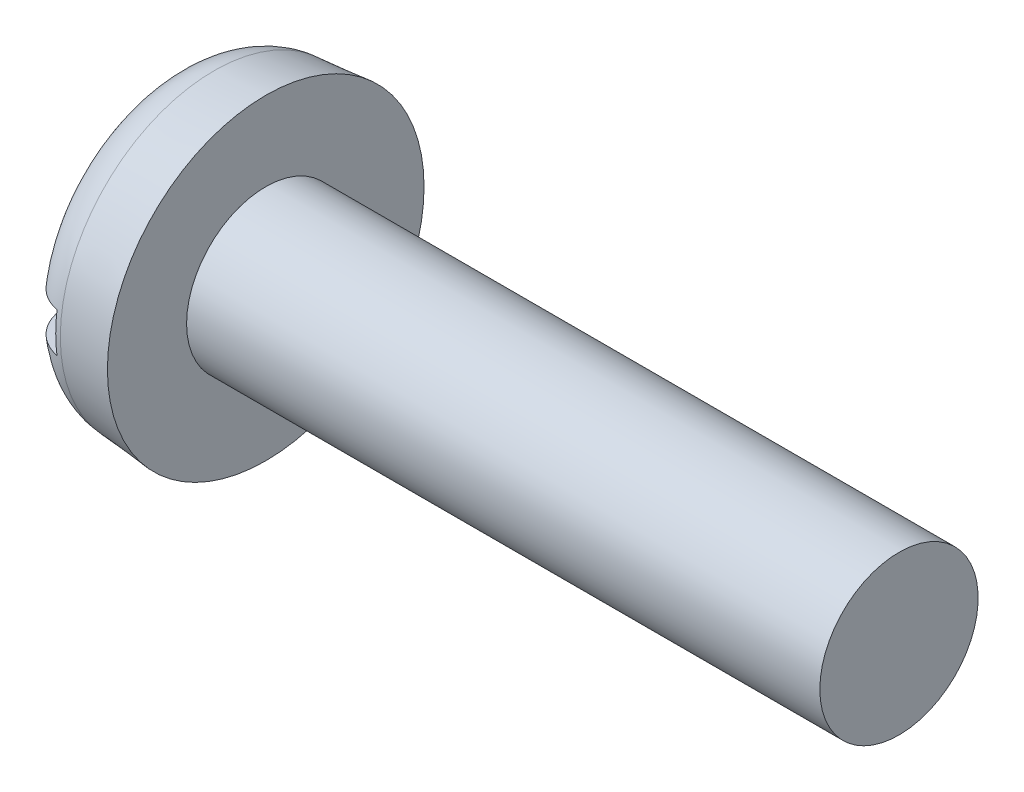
SolidWorks part; units mm, degrees
ref_plane "Plane1" through (0, 0, 0) normal (0, 0, 1) x (1, 0, 0)
ref_plane "Plane2" through (0, 0, 0) normal (0, 1, 0) x (1, 0, 0)
ref_plane "Plane3" through (0, 0, 0) normal (1, 0, 0) x (0, 0, -1)
other "Configuration Table"
sketch "BodySke" plane through (0, 0, 0) normal (0, 0, 1) x (1, 0, 0)
  line L0 (6, 5) -> (6, 10)
  line L1 (0, 0) -> (0, 9.4751)
  line L2 (-25.4, 0) -> (127, 0) construction
  line L3 (46, 0) -> (0, 0)
  line L4 (6, 5) -> (46, 5)
  line L5 (46, 5) -> (46, 0)
  line L6 (0, 9.4751) -> (6, 10)
  line L9 (7.5, 6.5875) -> (7.5, -2.9375) construction
  line L10 (6, 6.35) -> (6, -3.175) construction
revolve "Base-Revolve" add sketch "BodySke"
fillet "Fillet1" [suppressed] radius 0.4
fillet "Fillet2" radius 3 1 edges at (0, 0, 9.4751)
sketch "Sketch2" plane through (0, 0, 0) normal (1, 0, 0) x (0, 0, -1)
  line L0 (10, -1.25) -> (-10, -1.25)
  line L1 (10, -1.25) -> (10, 1.25)
  line L2 (-10, 1.25) -> (10, 1.25)
  line L3 (-10, 1.25) -> (-10, -1.25)
extrude "Slot" cut sketch "Sketch2" along normal blind 2.4
sketch "ThdSchSke" plane through (0, 0, 0) normal (0, 0, 1) x (1, 0, 0)
  line L0 (9, -4.1885) -> (8.4318, -5)
  line L1 (9, -4.1885) -> (9.5682, -5)
  line L2 (9.5682, -5) -> (9.5682, -6.25)
  line L3 (-3.175, 0) -> (5.1513, 0) construction
  line L5 (9.5682, -6.25) -> (8.4318, -6.25)
  line L6 (8.4318, -6.25) -> (8.4318, -5)
revolve "ThreadSchematic" [suppressed] cut sketch "ThdSchSke" angle 360 about L3
pattern_linear "ThdSchPat" [suppressed]
equation "\"D1@Sketch2\" = \"Head_dia@BodySke\""
equation "\"D2@Sketch2\" = \"D1@Sketch2\" / 2"
equation "\"D3@Sketch2\" = \"Slot_width@Sketch2\" / 2"
equation "\"Thread_length@ThreadCosmetic\" = ((sgn( (\"Length@BodySke\" - \"Advance@BodySke\" * 2.0 ) - \"Thread_nom@BodySke\" )-1)*( (\"Length@BodySke\" - \"Advance@BodySke\"  * 2.0) - \"Thread_nom@BodySke\" ))/-2+ \"Thread_"
equation "\"Thread_minor@ThdSchSke\" = \"Thread_minor@ThreadCosmetic\""
equation "\"Diameter@ThdSchSke\" = \"Diameter@BodySke\""
equation "\"Overcut@ThdSchSke\" = \"Diameter@BodySke\" * 1.25"
equation "\"Start@ThdSchSke\" = \"Head_ht@BodySke\" + \"Length@BodySke\" - \"Thread_length@ThreadCosmetic\"  '---Non-countersunk---"
equation "\"Num_threads@ThdSchPat\" = int( \"Thread_length@ThreadCosmetic\" / \"Advance@BodySke\" + 0.999 )  + 1"
equation "\"Advance@ThdSchPat\" = \"Thread_length@ThreadCosmetic\" /  (\"Num_threads@ThdSchPat\" - 1) 'relax it"
